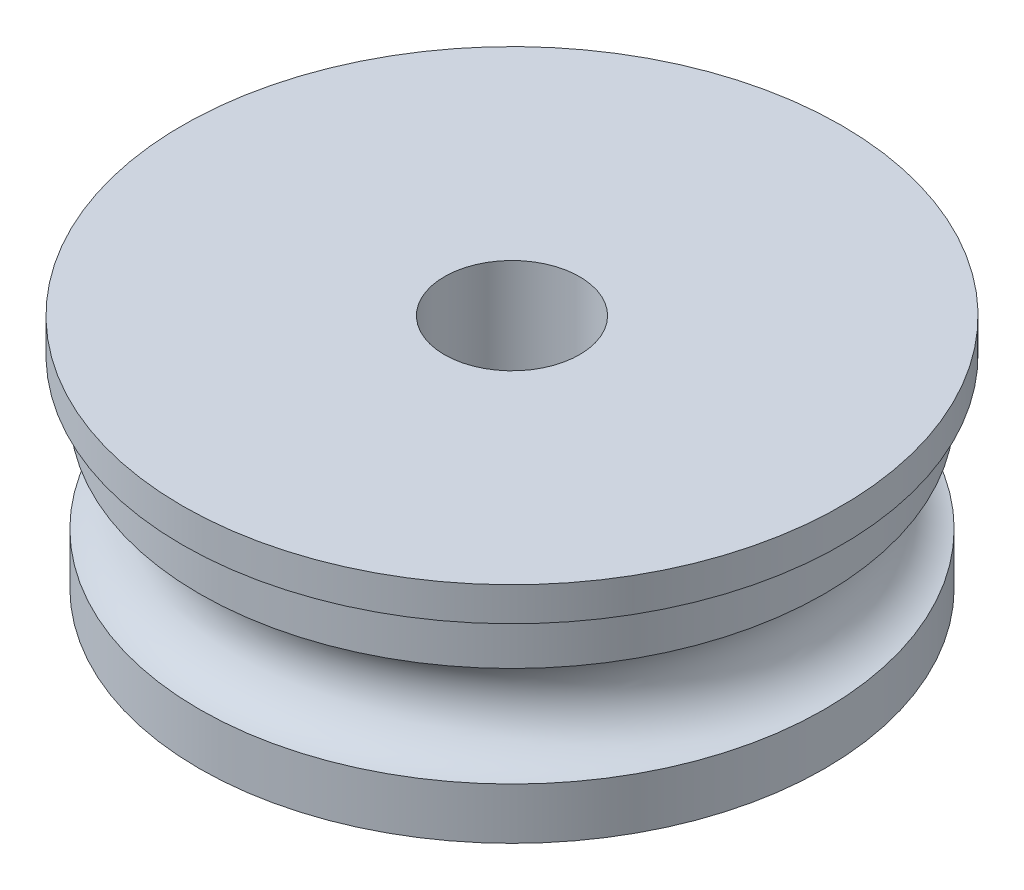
SolidWorks part; units mm, degrees
ref_plane "Front Plane" through (0, 0, 0) normal (0, 0, 1) x (1, 0, 0)
ref_plane "Top Plane" through (0, 0, 0) normal (0, 1, 0) x (1, 0, 0)
ref_plane "Right Plane" through (0, 0, 0) normal (1, 0, 0) x (0, 0, -1)
sketch "Sketch1" plane through (0, 0, 0) normal (0, 0, 1) x (1, 0, 0)
  line L0 (0, 0) -> (0, -9052.1943) construction
  line L1 (0, 0) -> (9052.1943, 0) construction
  line L2 (-9.75, 6.9804) -> (-2, 6.9804)
  line L3 (-9.75, 6.9804) -> (-9.75, 5.9804)
  line L4 (-9.75, 5.9804) -> (-9.25, 5.9804)
  line L5 (-9.25, 5.9804) -> (-9.25, 4.4804)
  line L6 (-9.25, 1.5196) -> (-9.25, 0)
  line L7 (-2, 3) -> (-6, 3)
  line L8 (-2, 6.9804) -> (-2, 3)
  line L9 (-6, 3) -> (-6, 0)
  line L10 (-9.25, 0) -> (-6, 0)
  arc A0 (-9.25, 4.4804) -> (-9.25, 1.5196) centre (-9.492, 3) cw
  dimension "D5" = 1.5
  dimension "D1" = 19.5
  dimension "D2" = 18.5
  dimension "D3" = 1
  dimension "D4" = 1.5
  dimension "D6" = 3
  dimension "D7" = 18.5
  dimension "D8" = 4
  dimension "D9" = 12
  dimension "D10" = 1.5196
  dimension "D11" = 3
revolve "Revolve1" add sketch "Sketch1" angle 360 about L0
